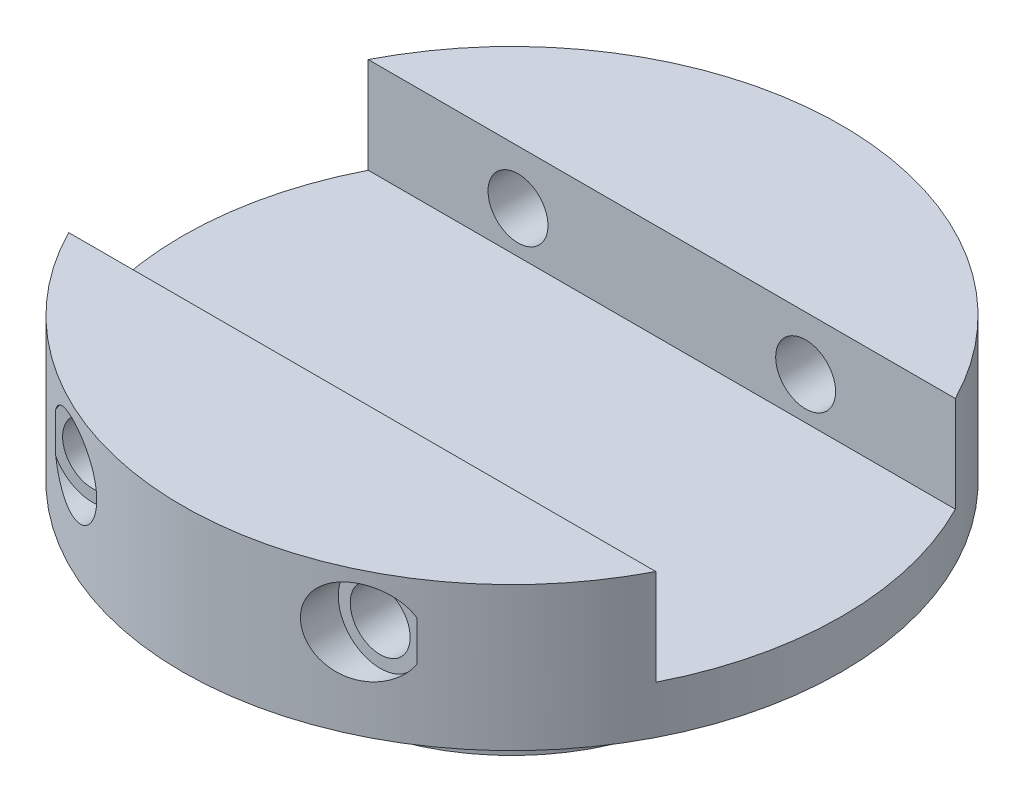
SolidWorks part; units mm, degrees
ref_plane "Top" through (0, 0, 0) normal (0, 0, 1) x (1, 0, 0)
ref_plane "Right" through (0, 0, 0) normal (0, 1, 0) x (1, 0, 0)
ref_plane "Front" through (0, 0, 0) normal (1, 0, 0) x (0, 0, -1)
sketch "Sketch2" plane through (0, 0, 0) normal (0, 1, 0) x (1, 0, 0)
  circle A0 centre (0, 0) radius 43.6562
  dimension "D1" = 87.3125
extrude "Base-Extrude" add sketch "Sketch2" along normal blind 19.05
sketch "Sketch4" plane through (0, 0, 0) normal (0, -1, 0) x (1, 0, 0)
  circle A0 centre (0, 0) radius 25.3619
  dimension "D1" = 50.7238
extrude "Boss-Extrude1" add sketch "Sketch4" along normal blind 13.4937
sketch "Sketch5" plane through (0, 0, 0) normal (1, 0, 0) x (0, 0, -1)
  line L0 (-19.8438, 19.05) -> (19.8438, 19.05)
  line L1 (-19.8438, 19.05) -> (-19.8438, 6.35)
  line L2 (19.8437, 6.35) -> (-19.8438, 6.35)
  line L3 (19.8437, 6.35) -> (19.8438, 19.05)
  line L4 (-43.6562, 19.05) -> (43.6562, 19.05) construction
  line L5 (0, 27.9661) -> (0, -22.2319) construction
  line L6 (0, -13.4937) -> (0, 0) construction
  dimension "D1" = 39.6875
  dimension "D2" = 12.7
extrude "Cut-Extrude1" cut sketch "Sketch5" against normal through all and the other way through all
sketch "Sketch7" plane through (0, 0, 0) normal (0, 0, 1) x (1, 0, 0)
  line L0 (0, 32.5053) -> (0, -19.2058) construction
  line L1 (0, -13.4937) -> (0, 0) construction
  line L2 (-38.8856, 19.05) -> (38.8856, 19.05) construction
  circle A0 centre (-19.05, 11.9063) radius 3.9688
  dimension "D3" = 7.9375
  dimension "D1" = 19.05
  dimension "D2" = 7.1437
extrude "Cut-Extrude2" cut sketch "Sketch7" along normal through all
ref_plane "Plane1" through (0, 0, 36.5125) normal (0, 0, 1) x (1, 0, 0)
sketch "Sketch8" plane through (0, 0, 36.5125) normal (0, 0, 1) x (1, 0, 0)
  circle A0 centre (-19.05, 11.9063) radius 5.5562
  dimension "D1" = 11.1125
extrude "Cut-Extrude3" cut sketch "Sketch8" along normal through all
mirror "Mirror1" about plane through (0, 0, 0) normal (1, 0, 0) of "Cut-Extrude2", "Cut-Extrude3"
mirror "Mirror2" about plane through (0, 0, 0) normal (0, 0, 1) of "Cut-Extrude3", "Cut-Extrude2", "Mirror1"
